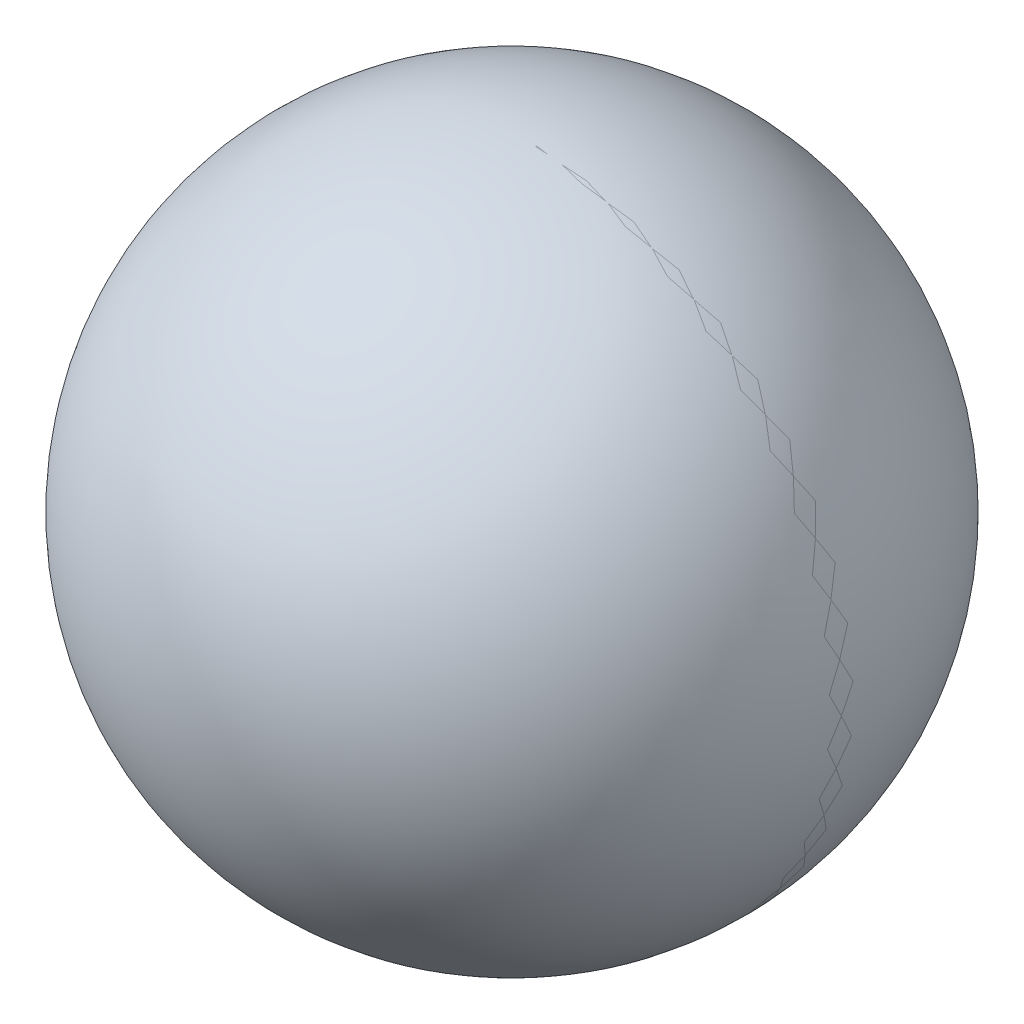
SolidWorks part; units mm, degrees
ref_plane "Front Plane" through (0, 0, 0) normal (0, 0, 1) x (1, 0, 0)
ref_plane "Top Plane" through (0, 0, 0) normal (0, 1, 0) x (1, 0, 0)
ref_plane "Right Plane" through (0, 0, 0) normal (1, 0, 0) x (0, 0, -1)
sketch "Sketch1" plane through (0, 0, 0) normal (0, 0, 1) x (1, 0, 0)
  line L0 (0, 0) -> (0, 0.0001) construction
  line L1 (0, 0) -> (0, 0.0001)
  line L2 (0, 79.9999) -> (0, 80) construction
  line L3 (0, 79.9999) -> (0, 80)
  arc A0 (0, 80) -> (0, 0) centre (0, 40) cw
  arc A1 (0, 0.0001) -> (0, 79.9999) centre (0, 40) ccw
  dimension "D1" = 40
  dimension "D2" = 0.0001
revolve "Revolve2" add sketch "Sketch1" angle 360 about L3
